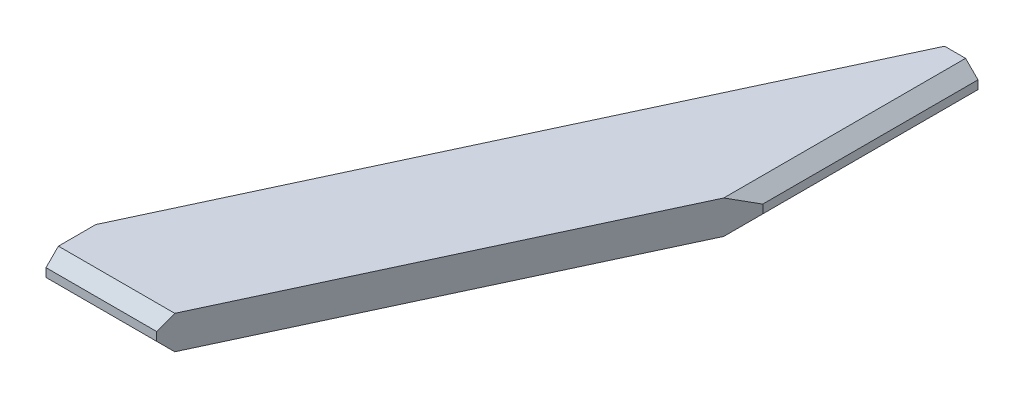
SolidWorks part; units mm, degrees
ref_plane "Front Plane" through (0, 0, 0) normal (1, 0, 0) x (0, 1, 0)
ref_plane "Top Plane" through (0, 0, 0) normal (0, 0, 1) x (0, 1, 0)
ref_plane "Right Plane" through (0, 0, 0) normal (0, 1, 0) x (-1, 0, 0)
sketch "sk w193" plane through (0, 0, 0) normal (0, 0, 1) x (0, 1, 0)
  point P0 (-399.034, -196.596)
  point P3 (-188.214, 0)
  line B0 (-399.034, -196.596) -> (-399.034, -160.02)
  line B1 (-399.034, -160.02) -> (-226.06, -160.02)
  line B2 (-210.82, -144.78) -> (-210.82, 144.78)
  line B3 (-226.06, 160.02) -> (-399.034, 160.02)
  line B4 (-399.034, 160.02) -> (-399.034, 196.596)
  line B5 (-399.034, 196.596) -> (0, 196.596)
  line B6 (0, 196.596) -> (0, 160.02)
  line B7 (0, 160.02) -> (-172.974, 160.02)
  line B8 (-188.214, 144.78) -> (-188.214, -144.78)
  line B9 (-172.974, -160.02) -> (0, -160.02)
  line B10 (0, -160.02) -> (0, -196.596)
  line B11 (0, -196.596) -> (-399.034, -196.596)
  arc B12 (-226.06, -160.02) -> (-210.82, -144.78) centre (-226.06, -144.78) ccw
  arc B13 (-210.82, 144.78) -> (-226.06, 160.02) centre (-226.06, 144.78) ccw
  arc B14 (-172.974, 160.02) -> (-188.214, 144.78) centre (-172.974, 144.78) ccw
  arc B15 (-188.214, -144.78) -> (-172.974, -160.02) centre (-172.974, -144.78) ccw
sketch_block_instance "w14x193-1-1"
sketch_block "w14x193-1" parameters "D4"=15.24, "D1"=399.034, "D2"=393.192, "D3"=22.606, "D5"=36.576
sketch "Sketch2" plane through (0, 0, 0) normal (0, 0, 1) x (0, 1, 0)
  line L0 (320, 501.4782) -> (320, -809.7231)
  line L1 (-188.214, 144.78) -> (-188.214, -144.78)
  line L2 (-188.214, -144.78) -> (-172.974, -160.02)
  line L3 (-172.974, -160.02) -> (5, -160.02)
  line L4 (-188.214, 144.78) -> (-172.974, 160.02)
  line L5 (-172.974, 160.02) -> (5, 160.02)
  line L6 (5, 201.596) -> (5, 160.02)
  line L7 (0, 196.596) -> (0, 160.02) construction
  line L8 (5, -160.02) -> (5, -201.596)
  line L9 (-285.82, 201.596) -> (5, 201.596)
  line L10 (-285.82, -201.596) -> (5, -201.596)
  line L11 (-285.82, 201.596) -> (-285.82, 239.696)
  line L12 (-285.82, 239.696) -> (167.6, 501.4782)
  line L13 (-285.82, -201.596) -> (-285.82, -239.696)
  line L14 (-285.82, -239.696) -> (167.6, -809.7231)
  line L15 (-210.82, -144.78) -> (-210.82, 144.78) construction
  line L16 (-399.034, 196.596) -> (0, 196.596) construction
  line L17 (0, -196.596) -> (-399.034, -196.596) construction
  line L18 (320, 501.4782) -> (167.6, 501.4782)
  line L19 (320, -809.7231) -> (167.6, -809.7231)
  point P30 (320, 501.4782)
  point P31 (320, -809.7231)
  dimension "D1" = 320
  dimension "D2" = 5
  dimension "D3" = 75
  dimension "D4" = 5
  dimension "D5" = 5
  dimension "D6" = 30
  dimension "D7" = 51.5
  dimension "D8" = 38.1
  dimension "D9" = 38.1
  dimension "D10" = 152.4
sketch "Sketch3" plane through (0, 0, 0) normal (0, 1, 0) x (-1, 0, 0)
  line L5 (63.2625, 285.9208) -> (179.0815, 285.9208)
  line L10 (179.0815, 285.9208) -> (179.0815, 233.7878)
  line L11 (179.0815, 233.7878) -> (-103.672, -372.5792)
  line L12 (-103.672, -372.5792) -> (-138.672, -372.5792)
  line L13 (-138.672, -372.5792) -> (-138.672, -147.1294)
  line L14 (63.2625, 285.9208) -> (-138.672, -147.1294)
  line L15 (-37.7047, 69.3957) -> (37.7047, -69.3957) construction
  point P8 (0, 0)
  dimension "D1" = 35
  dimension "D2" = 127
  dimension "D3" = 115.819
  dimension "D5" = 65
  dimension "D6" = 658.5
extrude "Boss-Extrude1" add sketch "Sketch3" along normal mid plane 34.925
chamfer "Chamfer1" distance 13 angle 45 4 edges at (138.672, 17.4625, -259.8543) (138.672, -17.4625, -259.8543) (-121.172, -17.4625, 285.9208) (-121.172, 17.4625, 285.9208)
